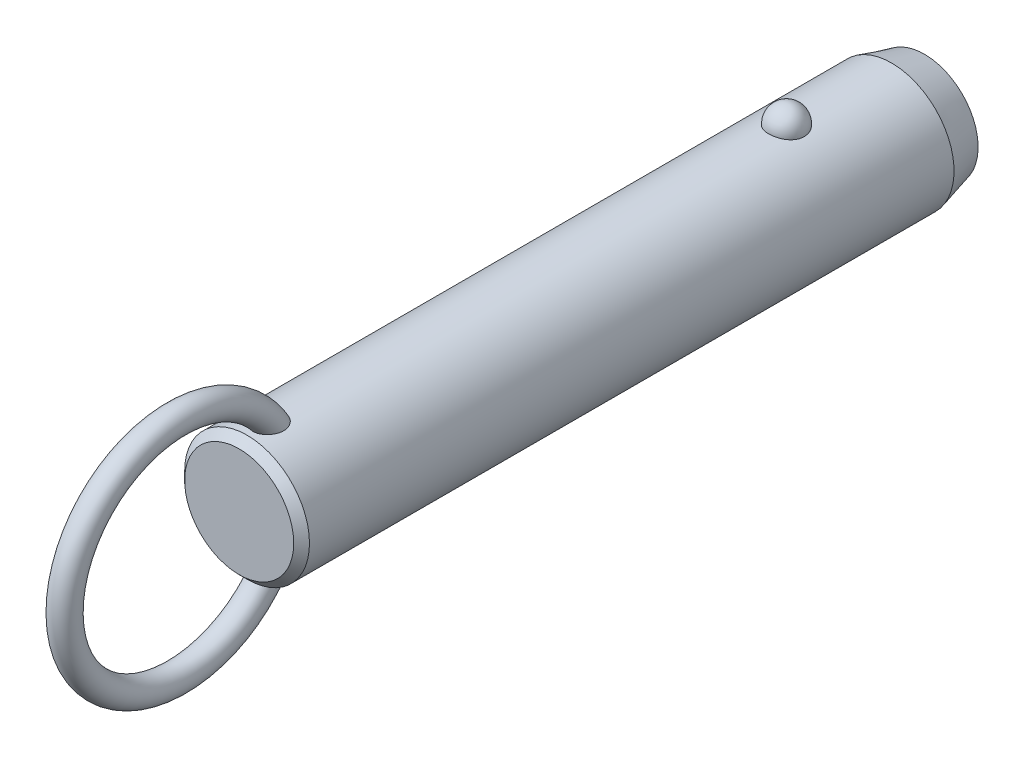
SolidWorks part; units mm, degrees
ref_plane "Front Plane" through (0, 0, 0) normal (0, 0, 1) x (1, 0, 0)
ref_plane "Top Plane" through (0, 0, 0) normal (0, 1, 0) x (1, 0, 0)
ref_plane "Right Plane" through (0, 0, 0) normal (1, 0, 0) x (0, 0, -1)
sketch "Sketch2" plane through (0, 0, 0) normal (0, 0, 1) x (1, 0, 0)
  circle A0 centre (0, 0) radius 9.5
  point P3 (0, 9.5)
  dimension "D1" = 19
extrude "Boss-Extrude1" add sketch "Sketch2" along normal blind 71.1
sketch "Sketch3" plane through (0, 0, 0) normal (0, 0, -1) x (-1, 0, 0)
  circle A0 centre (0, 0) radius 9.5
  dimension "D1" = 19
extrude "Boss-Extrude2" add sketch "Sketch3" along normal blind 23.7
chamfer "Chamfer1" distance 5 angle 15 1 edges at (-9.5, 0, -23.7)
sketch "Sketch12" plane through (0, 0, 0) normal (1, 0, 0) x (0, 0, -1)
  line L0 (-71.1, 9.5) -> (-71.1, -9.5) construction
  point P0 (-71.1, 0)
sketch "Sketch13" plane through (0, 0, 0) normal (1, 0, 0) x (0, 0, -1)
  circle A0 centre (-90.15, 0) radius 19.05
  point P2 (-71.1, 0)
  dimension "D1" = 38.1
sketch "Sketch14" plane through (0, 0, 0) normal (0, 1, 0) x (1, 0, 0)
  circle A0 centre (0, -73.1) radius 2
  point P2 (0, -71.1)
  dimension "D1" = 4
sweep "Sweep1" add profiles "Sketch14" path "Sketch13"
sketch "Sketch15" plane through (0, 0, 71.1) normal (0, 0, 1) x (1, 0, 0)
  circle A0 centre (0, 0) radius 9.5
  dimension "D1" = 19
extrude "Boss-Extrude3" add sketch "Sketch15" along normal blind 9.52
chamfer "Chamfer2" distance 1.2 angle 45 1 edges at (9.5, 0, 80.62)
sketch "Sketch18" plane through (0, 0, 0) normal (1, 0, 0) x (0, 0, -1)
  line L0 (18.7, 9.5) -> (-73.6378, 9.5) construction
  line L1 (2.7, 12.2) -> (2.7, 6.8)
  line L2 (-73.6378, -9.5) -> (18.7, -9.5) construction
  arc A0 (2.7, 12.2) -> (2.7, 6.8) centre (2.7, 9.5) ccw
  point P4 (0, 9.5)
  dimension "D1" = 21.7
revolve "Revolve1" add sketch "Sketch18" angle 360 about L1
